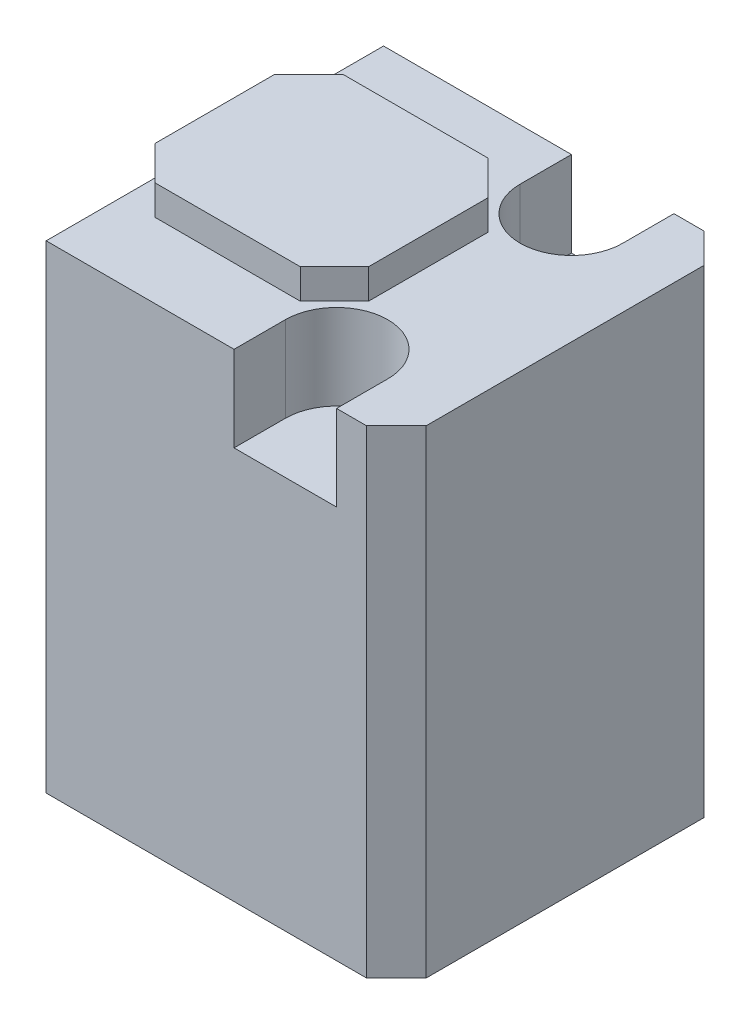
SolidWorks part; units mm, degrees
ref_plane "Front" through (0, 0, 0) normal (0, 0, 1) x (1, 0, 0)
ref_plane "Top" through (0, 0, 0) normal (0, 1, 0) x (1, 0, 0)
ref_plane "Right" through (0, 0, 0) normal (1, 0, 0) x (0, 0, -1)
sketch "Sketch1" plane through (0, 0, 0) normal (0, 1, 0) x (1, 0, 0)
  line L1 (0, 0) -> (10.414, 0)
  line L2 (0, 0) -> (0, 10.033)
  line L3 (0, 10.033) -> (10.414, 10.033)
  line L4 (10.414, 0) -> (10.414, 10.033)
  dimension "D1" = 10.033
  dimension "D2" = 10.414
extrude "Extrude1" add sketch "Sketch1" along normal blind 14.224
chamfer "Chamfer1" distance 0.889 angle 45 2 edges at (10.414, 7.112, -10.033) (10.414, 7.112, 0)
sketch "Sketch2" plane through (0, 14.224, 0) normal (0, 1, 0) x (-1, 0, 0)
  line L0 (0, 0) -> (-9.525, 0) construction
  line L1 (-5.588, 0) -> (-8.636, 0)
  line L2 (-5.588, 0) -> (-5.588, -1.524)
  line L4 (-8.636, 0) -> (-8.636, -1.524)
  line L5 (-10.414, -0.889) -> (-10.414, -9.144) construction
  arc A0 (-8.636, -1.524) -> (-5.588, -1.524) centre (-7.112, -1.524) ccw
  dimension "D1" = 3.048
  dimension "D2" = 1.778
  dimension "D3" = 1.524
extrude "Cut-Extrude1" cut sketch "Sketch2" against normal blind 2.54
ref_plane "Plane1" through (0, 0, -5.0165) normal (0, 0, 1) x (1, 0, 0)
mirror "Mirror1" about plane through (0, 0, -5.0165) normal (0, 0, 1) of "Cut-Extrude1"
sketch "Sketch3" plane through (0, 14.224, 0) normal (0, 1, 0) x (-1, 0, 0)
  line L1 (-1.016, -2.2225) -> (-5.334, -2.2225)
  line L2 (0, -3.2385) -> (0, -6.7945)
  line L3 (-1.016, -7.8105) -> (-5.334, -7.8105)
  line L4 (-6.35, -3.2385) -> (-6.35, -6.7945)
  line L5 (-5.334, -2.2225) -> (-6.35, -3.2385)
  line L6 (-6.35, -6.7945) -> (-5.334, -7.8105)
  line L7 (0, -6.7945) -> (-1.016, -7.8105)
  line L8 (0, -3.2385) -> (-1.016, -2.2225)
  line L9 (0, -10.033) -> (0, 0) construction
  dimension "D1" = 6.35
  dimension "D2" = 5.588
  dimension "D3" = 2.2225
  dimension "D4" = 45
  dimension "D5" = 45
  dimension "D6" = 45
  dimension "D7" = 1.016
extrude "Extrude2" add sketch "Sketch3" along normal blind 0.889
